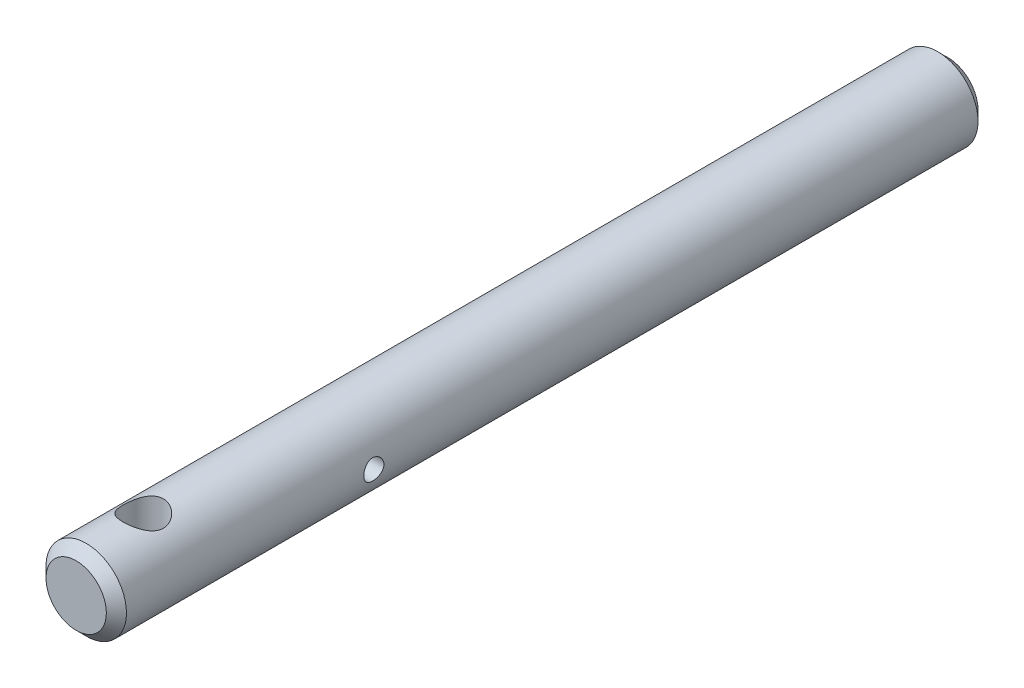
SolidWorks part; units mm, degrees
ref_plane "Plan1" through (0, 0, 0) normal (0, 0, 1) x (1, 0, 0)
ref_plane "plan2" through (0, 0, 0) normal (0, 1, 0) x (1, 0, 0)
ref_plane "Plan3" through (0, 0, 0) normal (1, 0, 0) x (0, 0, -1)
sketch "Esquisse1" plane through (0, 0, 0) normal (0, 0, 1) x (1, 0, 0)
  circle A0 centre (0, 0) radius 6
  dimension "D1" = 12
extrude "Base-Extrusion" add sketch "Esquisse1" against normal blind 130
chamfer "Chanfrein1" distance 1.5 angle 45
sketch "Esquisse4" plane through (0, 0, 0) normal (0, 1, 0) x (1, 0, 0)
  line L0 (-4.5, 0) -> (4.5, 0) construction
  circle A0 centre (0, 10) radius 3
  dimension "D1" = 6
  dimension "D2" = 10
extrude "Enlèv. mat.-Extru.1" cut sketch "Esquisse4" against normal mid plane 20
sketch "Esquisse6" plane through (0, 0, 0) normal (1, 0, 0) x (0, 0, -1)
  line L0 (0, 4.5) -> (0, -4.5) construction
  circle A0 centre (38.4, 0) radius 1.5
  dimension "D1" = 3
  dimension "D2" = 38.4
extrude "Enlèv. mat.-Extru.2" cut sketch "Esquisse6" against normal mid plane 20
